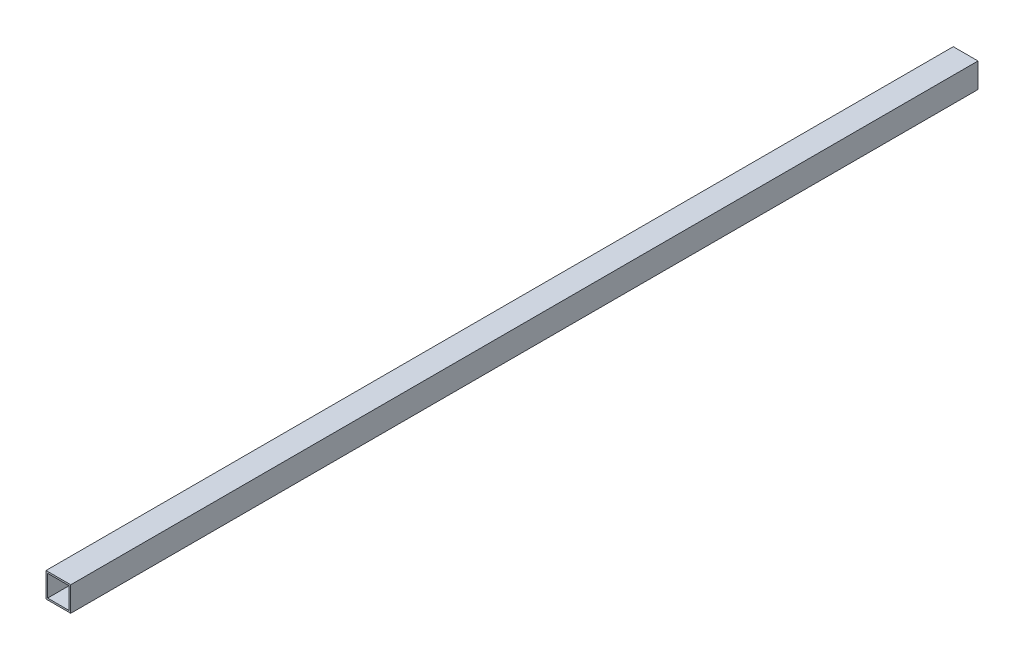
SolidWorks part; units mm, degrees
ref_plane "Plan de face" through (0, 0, 0) normal (0, 0, 1) x (1, 0, 0)
ref_plane "Plan de dessus" through (0, 0, 0) normal (0, 1, 0) x (1, 0, 0)
ref_plane "Plan de droite" through (0, 0, 0) normal (1, 0, 0) x (0, 0, -1)
sketch "Esquisse1" plane through (0, 0, 0) normal (0, 0, 1) x (1, 0, 0)
  line L0 (-32.7851, 0) -> (47.4143, 0) construction
  line L1 (-15, 15) -> (15, 15)
  line L2 (-15, 15) -> (-15, -15)
  line L3 (-15, -15) -> (15, -15)
  line L4 (15, 15) -> (15, -15)
  line L5 (0, 21.8132) -> (0, -24.1643) construction
  dimension "D1" = 30
  dimension "D2" = 30
extrude "Extru.-Mince1" add sketch "Esquisse1" along normal blind 1100 thin
